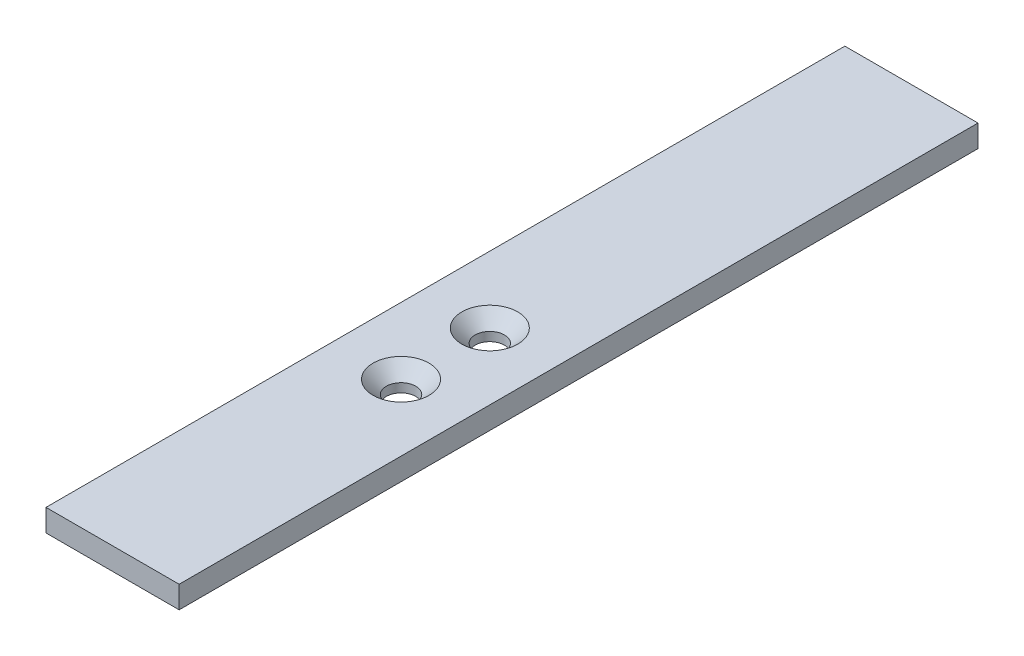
SolidWorks part; units mm, degrees
ref_plane "Plan de face" through (0, 0, 0) normal (0, 0, 1) x (1, 0, 0)
ref_plane "Plan de dessus" through (0, 0, 0) normal (0, 1, 0) x (1, 0, 0)
ref_plane "Plan de droite" through (0, 0, 0) normal (1, 0, 0) x (0, 0, -1)
sketch "Esquisse1" plane through (0, 0, 0) normal (0, 0, 1) x (1, 0, 0)
  line L1 (-15, 2.5) -> (15, 2.5)
  line L2 (-15, 2.5) -> (-15, -2.5)
  line L3 (-15, -2.5) -> (15, -2.5)
  line L4 (15, 2.5) -> (15, -2.5)
  dimension "D1" = 30
  dimension "D2" = 5
  dimension "D3" = 15
  dimension "D4" = 2.5
extrude "Extrusion1" add sketch "Esquisse1" along normal blind 180
hole_wizard "Fraisage pour vis à tête fraisée M61" positions "Esquisse3" profile "Esquisse2" countersink size "M6" standard "ISO"
sketch "Esquisse3" plane through (0, 2.5, 0) normal (0, 1, 0) x (-1, 0, 0)
  line L0 (-15, 0) -> (15, 0) construction
  line L1 (-15, 180) -> (-15, 0) construction
  point P0 (0, 115)
  point P1 (0, 95)
  dimension "D1" = 95
  dimension "D2" = 20
  dimension "D3" = 15
sketch "Esquisse2" plane through (0, 2.5, 115) normal (1, 0, 0) x (0, 0, 1)
  line L0 (0, 0) -> (0, 26.9828)
  line L1 (0, 26.9828) -> (3.3, 25)
  line L2 (3.3, 25) -> (3.3, 3)
  line L3 (3.3, 3) -> (6.3, 0)
  line L5 (6.3, 0) -> (0, 0)
  line L6 (-3.3, 3) -> (-6.3, 0) construction
  line L10 (0, 26.9828) -> (-3.3, 25) construction
  line L11 (0, -6.35) -> (0, 107.95) construction
  dimension "Diamètre du perçage" = 6.6
  dimension "Profondeur du perçage" = 25
  dimension "Diamètre du fraisage entrant" = 12.6
  dimension "Angle du fraisage entrant" = 90
  dimension "Angle de pointe" = 118
